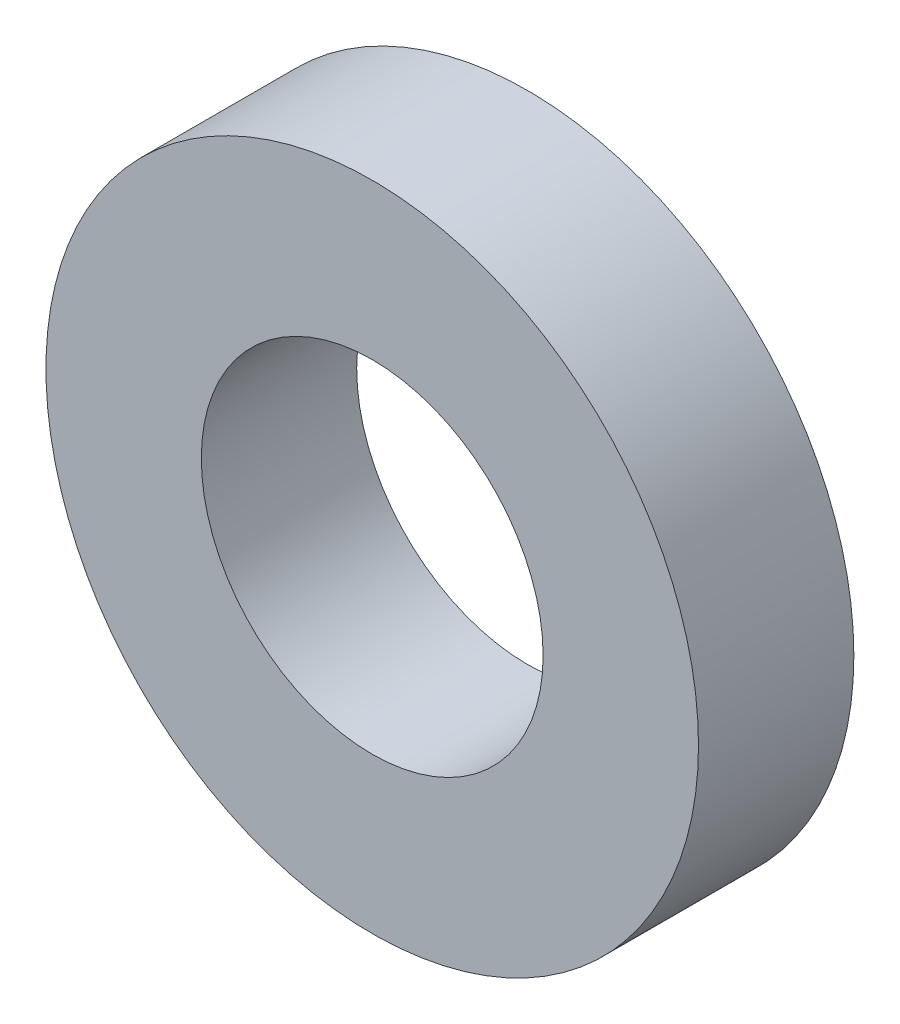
SolidWorks part; units mm, degrees
ref_plane "Front" through (0, 0, 0) normal (0, 0, 1) x (1, 0, 0)
ref_plane "Top" through (0, 0, 0) normal (0, 1, 0) x (1, 0, 0)
ref_plane "Right" through (0, 0, 0) normal (1, 0, 0) x (0, 0, -1)
other "Configuration Table"
sketch "Sketch1" plane through (0, 0, 0) normal (0, 0, 1) x (1, 0, 0)
  circle A0 centre (0, 0) radius 1.1
  circle A1 centre (0, 0) radius 2.1
  dimension "d" = 2.2
  dimension "D0" = 4.2
extrude "Base-Extrude" add sketch "Sketch1" against normal blind 1
